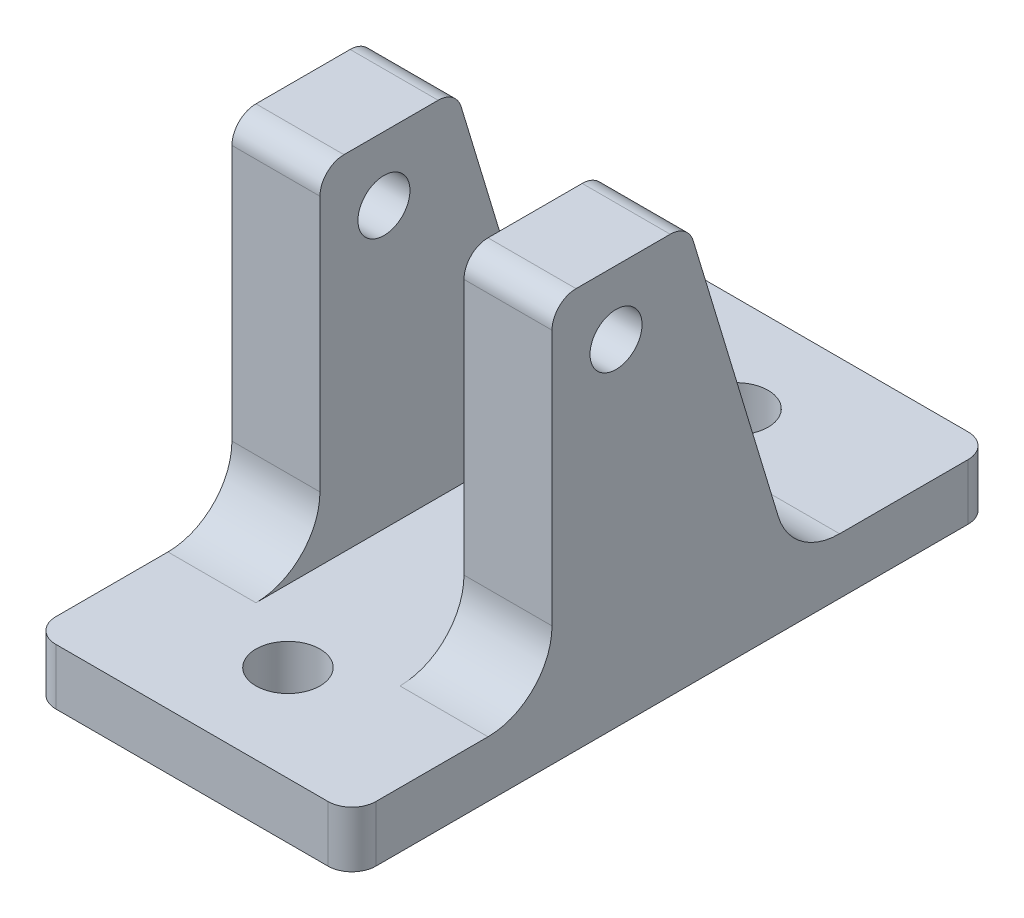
SolidWorks part; units mm, degrees
ref_plane "Front Plane" through (0, 0, 0) normal (0, 0, 1) x (1, 0, 0)
ref_plane "Top Plane" through (0, 0, 0) normal (0, 1, 0) x (1, 0, 0)
ref_plane "Right Plane" through (0, 0, 0) normal (1, 0, 0) x (0, 0, -1)
sketch "Sketch1" plane through (0, 0, 0) normal (0, 0, 1) x (1, 0, 0)
  line L0 (-6.5, -462.4225) -> (-6.5, 0) construction
  line L2 (2.5, -505.4225) -> (2.5, -462.4225)
  line L4 (-15.5, -505.4225) -> (-15.5, -462.4225)
  line L6 (-26.5, -462.4225) -> (-15.5, -462.4225)
  line L7 (-26.5, -462.4225) -> (-26.5, -505.4225)
  line L9 (13.5, -462.4225) -> (13.5, -505.4225)
  line L10 (-26.5, -505.4225) -> (-15.5, -505.4225)
  line L13 (2.5, -462.4225) -> (13.5, -462.4225)
  line L14 (-15.5, -462.4225) -> (2.5, -462.4225) construction
  line L15 (2.5, -505.4225) -> (13.5, -505.4225)
  line L16 (-15.5, -505.4225) -> (2.5, -505.4225) construction
  line L18 (10.6, -505.4225) -> (-23.4, -505.4225) construction
  dimension "D1" = 18
  dimension "D2" = 11
  dimension "D3" = 40
  dimension "D5" = 43
extrude "Boss-Extrude1" add sketch "Sketch1" along normal blind 25 contours L7 L10 L4 L6 | L9 L15 L2 L13
sketch "Sketch2" plane through (0, -505.4225, 0) normal (0, -1, 0) x (-1, 0, 0)
  line L0 (26.5, -25) -> (26.5, 0) construction
  line L1 (26.5, -50) -> (-13.5, -50)
  line L2 (26.5, -50) -> (26.5, 30)
  line L3 (26.5, 30) -> (-13.5, 30)
  line L4 (-13.5, -50) -> (-13.5, 30)
  line L6 (-2.5, -25) -> (-13.5, -25) construction
  line L7 (26.5, 0) -> (15.5, 0) construction
  line L8 (6.5, -50) -> (6.5, 30) construction
  line L10 (-13.5, -25) -> (-13.5, 0) construction
  circle A0 centre (6.5, -38) radius 4
  circle A1 centre (6.5, 18) radius 4
  dimension "D3" = 8
  dimension "D4" = 8
  dimension "D5" = 12
  dimension "D1" = 25
  dimension "D2" = 30
  dimension "D6" = 12
extrude "Boss-Extrude2" add sketch "Sketch2" along normal blind 7
sketch "Sketch4" plane through (0, 0, 0) normal (0, 0, -1) x (-1, 0, 0)
  line L4 (15.5, -505.4225) -> (26.5, -505.4225)
  line L5 (15.5, -505.4225) -> (26.5, -505.4225)
  line L12 (26.5, -505.4225) -> (26.5, -462.4225)
  line L13 (26.5, -462.4225) -> (15.5, -462.4225)
  line L14 (15.5, -462.4225) -> (15.5, -505.4225)
  line L20 (26.5, -505.4225) -> (26.5, -462.4225)
  line L21 (26.5, -462.4225) -> (15.5, -462.4225)
  line L22 (15.5, -462.4225) -> (15.5, -505.4225)
  dimension "D1" = 0
sketch "Sketch3" plane through (13.5, 0, 0) normal (1, 0, 0) x (0, 0, -1)
  line L0 (-17, -512.4225) -> (-17, -462.4225) construction
  line L1 (-25, -462.4225) -> (-25, -505.4225) construction
  line L2 (-25, -462.4225) -> (0, -462.4225) construction
  line L4 (30, -512.4225) -> (-50, -512.4225) construction
  circle A0 centre (-17, -470.4225) radius 3.25
  dimension "D2" = 6.5
  dimension "D1" = 8
  dimension "D3" = 42
extrude "Cut-Extrude1" cut sketch "Sketch3" against normal through all
sketch "Sketch7" plane through (0, 0, 0) normal (0, 0, -1) x (-1, 0, 0)
  line L1 (-13.5, -462.4225) -> (-2.5, -462.4225)
  line L2 (-13.5, -462.4225) -> (-13.5, -505.4225)
  line L3 (-13.5, -505.4225) -> (-2.5, -505.4225)
  line L4 (-2.5, -462.4225) -> (-2.5, -505.4225)
  line L5 (15.5, -462.4225) -> (26.5, -462.4225)
  line L6 (15.5, -462.4225) -> (15.5, -505.4225)
  line L7 (15.5, -505.4225) -> (26.5, -505.4225)
  line L8 (26.5, -462.4225) -> (26.5, -505.4225)
extrude "Boss-Extrude4" add sketch "Sketch7" along normal up to surface (30 mm away)
sketch "Sketch8" plane through (13.5, 0, 0) normal (1, 0, 0) x (0, 0, -1)
  line L1 (-25, -462.4225) -> (30, -462.4225) construction
  line L2 (30, -505.4225) -> (30, -462.4225)
  line L3 (30, -462.4225) -> (-8, -462.4225)
  line L4 (-8, -462.4225) -> (5, -505.4225)
  line L5 (-25, -505.4225) -> (30, -505.4225) construction
  line L6 (5, -505.4225) -> (30, -505.4225)
  dimension "D1" = 17
  dimension "D2" = 25
extrude "Cut-Extrude3" cut sketch "Sketch8" against normal through all
fillet "Fillet1" radius 8 4 edges at (-21, -505.4225, 25) (8, -505.4225, 25) (-21, -505.4225, -5) (8, -505.4225, -5)
fillet "Fillet2" radius 3 8 edges at (-21, -462.4225, 25) (-21, -462.4225, 8) (8, -462.4225, 25) (8, -462.4225, 8) (-26.5, -508.9225, 50) (13.5, -508.9225, 50) (-26.5, -508.9225, -30) (13.5, -508.9225, -30)
ref_plane "Mid-plane" through (-6.5, 0, 0) normal (1, 0, 0) x (0, 0, -1)
